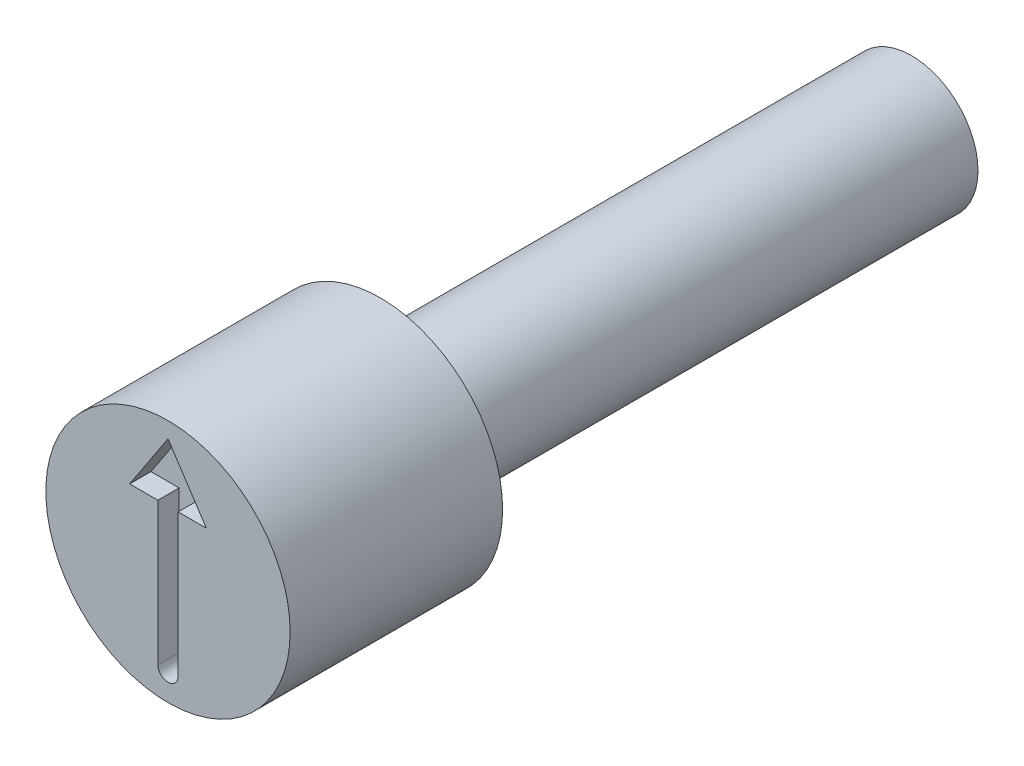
SolidWorks part; units mm, degrees
ref_plane "Front Plane" through (0, 0, 0) normal (0, 0, 1) x (1, 0, 0)
ref_plane "Top Plane" through (0, 0, 0) normal (0, 1, 0) x (1, 0, 0)
ref_plane "Right Plane" through (0, 0, 0) normal (1, 0, 0) x (0, 0, -1)
sketch "Sketch2" plane through (0, 0, 0) normal (1, 0, 0) x (0, 0, -1)
  line L0 (0.4039, 0) -> (50000.4039, 0) construction
  line L6 (0, 2.3) -> (0, 0)
  line L7 (4, 2.3) -> (0, 2.3)
  line L8 (4, 1.25) -> (4, 2.3)
  line L9 (14, 1.25) -> (4, 1.25)
  line L10 (14, 0) -> (14, 1.25)
  line L11 (0, 0) -> (14, 0)
  dimension "D1" = 4.6
  dimension "D2" = 2.5
  dimension "D3" = 14
  dimension "D4" = 4
revolve "Revolve1" add sketch "Sketch2" angle 360 about L0
sketch "Sketch3" plane through (0, 0, 0) normal (0, 0, 1) x (1, 0, 0)
  line L0 (0, 0) -> (0, 100000) construction
  line L1 (0.1905, 0.9064) -> (0.1905, -1.7762)
  line L2 (0.7219, 0.9064) -> (0.1905, 0.9064)
  line L3 (0, 2.0021) -> (0.7219, 0.9064)
  line L15 (0, 2.0021) -> (-0.7219, 0.9064)
  line L16 (-0.7219, 0.9064) -> (-0.1905, 0.9064)
  line L17 (-0.1905, 0.9064) -> (-0.1905, -1.7762)
  arc A2 (-0.1905, -1.7762) -> (0.1905, -1.7762) centre (0, -1.7762) ccw
extrude "Cut-Extrude4" cut sketch "Sketch3" against normal blind 0.4
